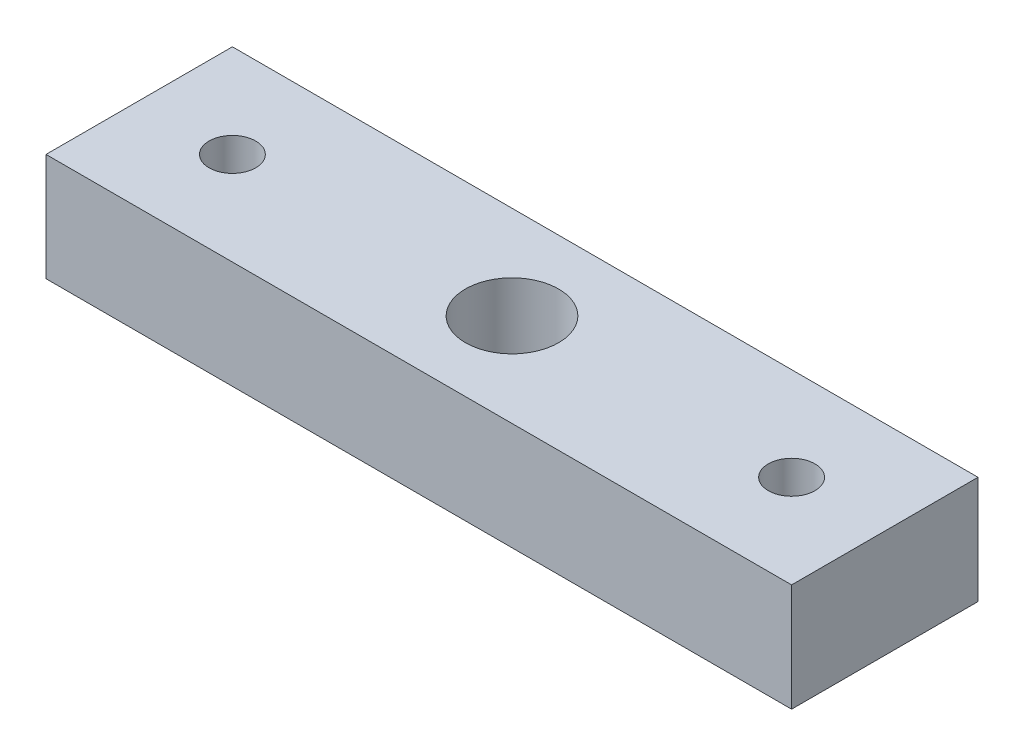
SolidWorks part; units mm, degrees
ref_plane "Front Plane" through (0, 0, 0) normal (0, 0, 1) x (1, 0, 0)
ref_plane "Top Plane" through (0, 0, 0) normal (0, 1, 0) x (1, 0, 0)
ref_plane "Right Plane" through (0, 0, 0) normal (1, 0, 0) x (0, 0, -1)
sketch "Sketch1" plane through (0, 0, 0) normal (0, 1, 0) x (1, 0, 0)
  line L1 (-203.2, -50.8) -> (203.2, -50.8)
  line L2 (-203.2, -50.8) -> (-203.2, 50.8)
  line L3 (-203.2, 50.8) -> (203.2, 50.8)
  line L4 (203.2, -50.8) -> (203.2, 50.8)
  line L5 (-203.2, -50.8) -> (203.2, 50.8) construction
  line L6 (-203.2, 50.8) -> (203.2, -50.8) construction
  circle A0 centre (-152.4, 0) radius 12.7
  circle A1 centre (152.4, 0) radius 12.7
  circle A2 centre (0, 0) radius 25.4
  point P0 (0, 0)
extrude "Boss-Extrude1" add sketch "Sketch1" along normal blind 58.6849
sketch "Sketch2" plane through (0, 0, 0) normal (0, -1, 0) x (1, 0, 0)
  line L0 (-171.45, 0) -> (-133.35, 0)
  line L1 (171.45, 0) -> (133.35, 0)
  point P1 (-133.35, 0)
  point P2 (-171.45, 0)
  point P5 (-152.4, 0)
  point P6 (133.35, 0)
  point P7 (171.45, 0)
  point P9 (152.4, 0)
hole_wizard "1/4-20 Tapped Hole1" positions "Sketch2" profile "Sketch3" tap size "1/4-20" standard "ANSI Inch"
sketch "Sketch3" plane through (-133.35, 0, 0) normal (1, 0, 0) x (0, 0, -1)
  line L0 (0, 0) -> (0, 33.2838)
  line L1 (0, 33.2838) -> (2.5527, 31.75)
  line L2 (2.5527, 31.75) -> (2.5527, 0)
  line L5 (2.5527, 0) -> (0, 0)
  line L10 (0, 33.2838) -> (-2.5527, 31.75) construction
  line L11 (0, -6.35) -> (0, 107.95) construction
  dimension "Tap Drill Dia." = 5.1054
  dimension "Tap Drill Depth" = 31.75
  dimension "Drill Angle" = 118
equation "\"L\"= 12'length, in"
equation "\"b\"= 4'base, in"
equation "\"E\"= 999310'modulus of elasticity 6063-T6, psi"
equation "\"w\"= 1798.5'load including SF, lbf"
equation "\"SF\"= 4'safety factor"
equation "\"max_defl\"= 0.00394'maximum deflection, in"
equation "\"h_defl\"= ( ( \"w\" * ( \"L\" ^ 3 ) ) / ( 16 * \"E\" * ( \"b\" ) * \"max_defl\" ) ) ^ ( 1 / 3 )'height calculated using deflection, in"
equation "\"SY\"= 310000'yield strength 6063-T6 psi"
equation "\"h_stress\"= ( \"F\" * \"SF\" ) / ( ( \"b\" - 2 ) * \"SY\" )'height calculated using stress, in"
equation "\"h_use\"= IIF ( \"h_stress\" > \"h_defl\" , \"h_stress\" , \"h_defl\" )'h use, in"
equation "\"D1@Sketch1\"=\"b\""
equation "\"overhang\"= 2'overhang pat center of lead screw, in"
equation "\"D2@Sketch1\"=\"L\"+(2*\"overhang\")"
equation "\"D4@Sketch1\"=\"L\"/2"
equation "\"D3@Sketch1\"=\"L\"/2"
equation "\"leadscrew_holes\"= 1'hole for lead screw"
equation "\"mounting_hole\"= 2'hole"
equation "\"D5@Sketch1\"=\"leadscrew_holes\""
equation "\"D6@Sketch1\"=\"leadscrew_holes\""
equation "\"D7@Sketch1\"=\"mounting_hole\""
equation "\"D1@Boss-Extrude1\"=\"h_use\""
equation "\"F\"= 449.6179'2000 N in lbf"
